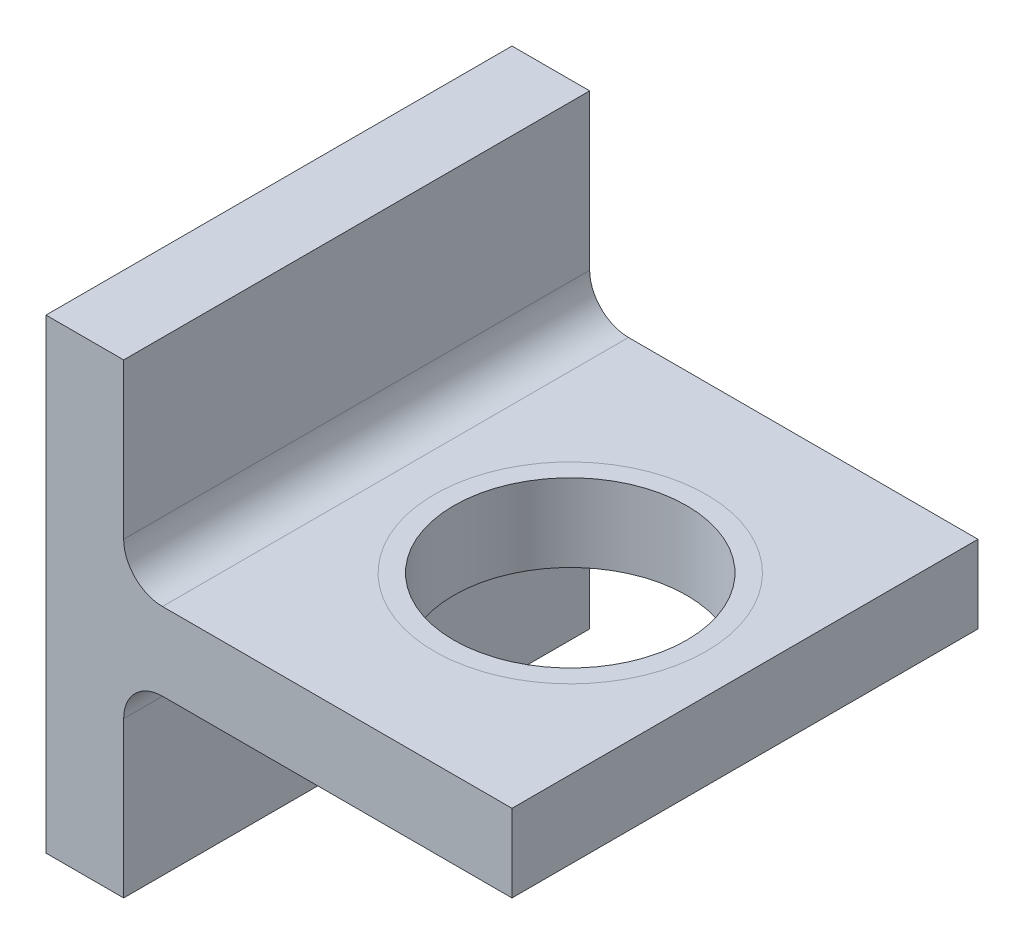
SolidWorks part; units mm, degrees
ref_plane "Front" through (0, 0, 0) normal (0, 0, 1) x (1, 0, 0)
ref_plane "Top" through (0, 0, 0) normal (0, 1, 0) x (1, 0, 0)
ref_plane "Right" through (0, 0, 0) normal (1, 0, 0) x (0, 0, -1)
sketch "Sketch1" plane through (0, 0, 0) normal (0, 0, 1) x (1, 0, 0)
  line L0 (-30.4308, 0) -> (136.341, 0) construction
  line L1 (0, -60) -> (20, -60)
  line L2 (0, -60) -> (0, 60)
  line L3 (0, 60) -> (20, 60)
  line L4 (20, -60) -> (20, -10)
  line L5 (20, -10) -> (120, -10)
  line L6 (20, 10) -> (120, 10)
  line L7 (120, 10) -> (120, -10)
  line L8 (20, 10) -> (20, 60)
  point P13 (20, 10)
  point P15 (20, -10)
  dimension "D1" = 60
  dimension "D2" = 120
  dimension "D4" = 20
  dimension "D5" = 100
extrude "Base-Extrude" add sketch "Sketch1" along normal blind 120
sketch "Sketch2" plane through (0, 0, 0) normal (0, 1, 0) x (-1, 0, 0)
  line L0 (-120, 120) -> (-20, 120) construction
  line L1 (-120, 120) -> (-120, 0) construction
  circle A0 centre (-75, 60) radius 30
  dimension "D1" = 60
  dimension "D3" = 45
  dimension "D2" = 60
fillet "Fillet1" radius 10 2 edges at (20, -10, 60) (20, 10, 60)
extrude "Extrude1" cut sketch "Sketch2" against normal through all and the other way through all
sketch "Sketch3" plane through (0, 10, 0) normal (0, 1, 0) x (1, 0, 0)
  circle A0 centre (75, -60) radius 35
  circle A1 centre (75, -60) radius 30 construction
  dimension "D1" = 70
fillet "fillet 2mm" [suppressed] radius 2
